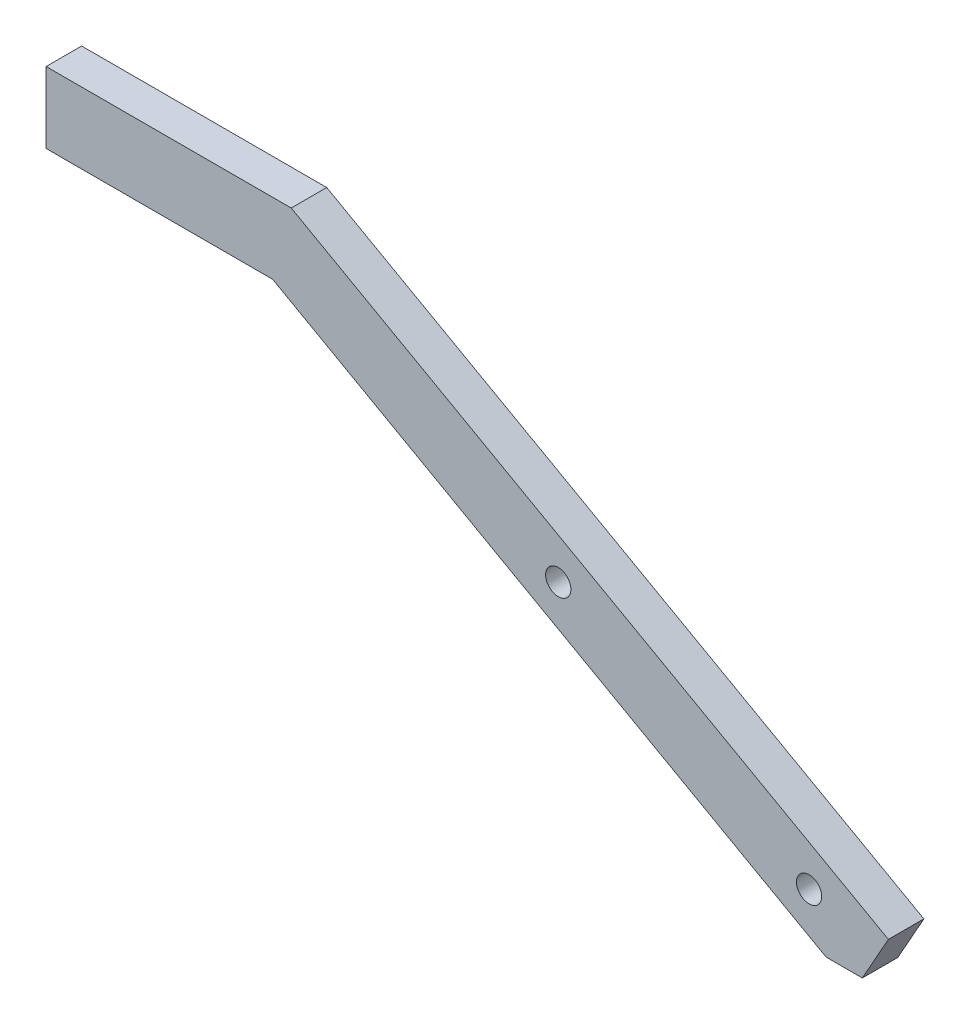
SolidWorks part; units mm, degrees
ref_plane "Front" through (0, 0, 0) normal (0, 0, 1) x (1, 0, 0)
ref_plane "Top" through (0, 0, 0) normal (0, 1, 0) x (1, 0, 0)
ref_plane "Right" through (0, 0, 0) normal (1, 0, 0) x (0, 0, -1)
sketch "Sketch1" plane through (0, 0, 0) normal (0, 0, 1) x (1, 0, 0)
  line L0 (-12.9084, -55.336) -> (-15.2375, -59.4901)
  line L1 (-15.2375, -59.4901) -> (-18.4836, -59.4901)
  line L2 (-18.4836, -59.4901) -> (-67.9613, -31.75)
  line L3 (-67.9613, -31.75) -> (-88.2196, -31.75)
  line L4 (-12.9084, -55.336) -> (-66.3026, -25.4)
  line L5 (-42.4264, -42.4264) -> (-20, -55) construction
  line L6 (-40, -60) -> (40, -60) construction
  line L7 (-66.3026, -25.4) -> (-88.2196, -25.4)
  line L8 (-88.2196, -25.4) -> (-88.2196, -31.75)
  line L12 (-40, -60) -> (40, -60) construction
  line L15 (-86.6321, -18.4259) -> (-86.6321, -31.75) construction
  circle A4 centre (-20, -55) radius 1.5 construction
  circle A5 centre (-42.4264, -42.4264) radius 1.5 construction
  dimension "D3" = 6.35
  dimension "D4" = 4.7625
  dimension "D1" = 3.175
  dimension "D2" = 3.175
  dimension "D5" = 6.35
  dimension "D7" = 1.5875
extrude "Extrude1" add sketch "Sketch1" along normal blind 3.175
hole_wizard "#4-40 Tapped Hole1" positions "Sketch3" profile "Sketch4" tap size "#4-40" standard "Ansi Inch"
sketch "Sketch3" plane through (0, 0, 0) normal (0, 0, -1) x (-1, 0, 0)
  point P0 (20, -55)
  point P1 (42.4264, -42.4264)
sketch "Sketch4" plane through (-20, -55, 0) normal (1, 0, 0) x (0, 1, 0)
  line L0 (0, 0) -> (0, 3.175)
  line L1 (0, 3.175) -> (1.1303, 3.175)
  line L2 (1.1303, 3.175) -> (1.1303, 0)
  line L5 (1.1303, 0) -> (0, 0)
  line L11 (0, -6.35) -> (0, 107.95) construction
  dimension "Thru Tap Drill Dia." = 2.2606
  dimension "Thru Tap Drill Depth" = 3.175
